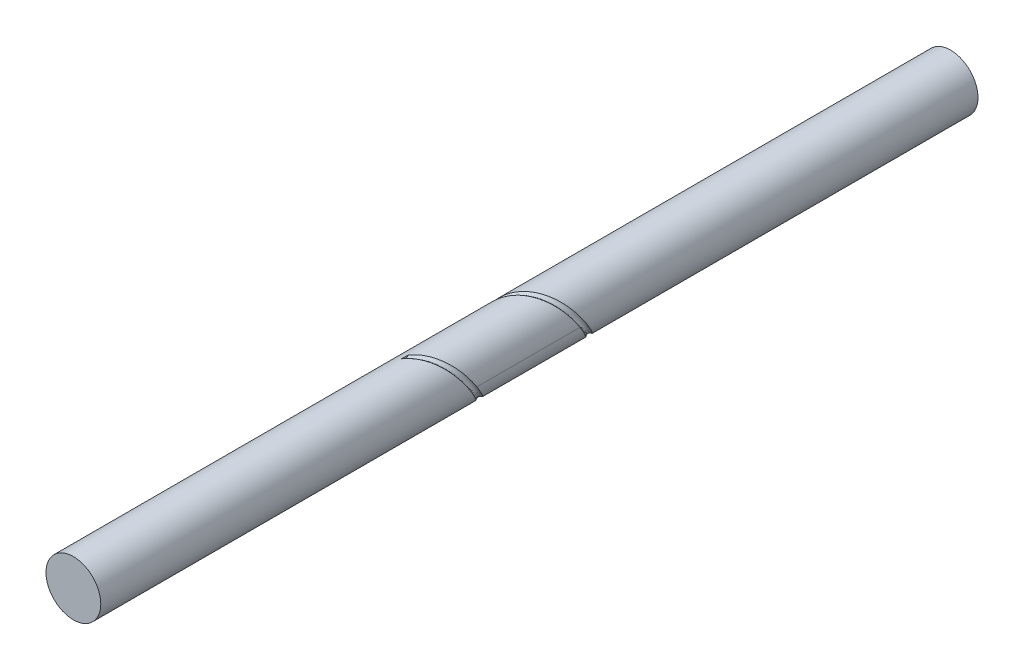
SolidWorks part; units mm, degrees
ref_plane "Front Plane" through (0, 0, 0) normal (0, 0, 1) x (1, 0, 0)
ref_plane "Top Plane" through (0, 0, 0) normal (0, 1, 0) x (1, 0, 0)
ref_plane "Right Plane" through (0, 0, 0) normal (1, 0, 0) x (0, 0, -1)
sketch "Sketch1" plane through (0, 0, 0) normal (0, 0, 1) x (1, 0, 0)
  circle A0 centre (0, 0) radius 25
  dimension "D1" = 50
extrude "Boss-Extrude1" add sketch "Sketch1" along normal blind 800
ref_plane "Plane1" through (0, 0, 310) normal (0, 0, 1) x (1, 0, 0)
sketch "Sketch2" plane through (0, 0, 310) normal (0, 0, 1) x (1, 0, 0)
  circle A0 centre (0, 0) radius 27.646
  dimension "D1" = 55.292
curve "Helix/Spiral1"
sketch "Sketch3" plane through (0, 0, 0) normal (0, 1, 0) x (1, 0, 0)
  circle A0 centre (-27.646, -310) radius 3.969
  spline S0 degree 3 poles (-27.646, -310) (-27.646, -311.3307) (-27.0608, -314.0012) (-24.4828, -317.9997) (-20.3663, -322.0001) (-14.9702, -326) (-8.6335, -330) (-1.7543, -334) (5.2352, -338) (11.8957, -342) (17.8087, -346) (22.6028, -350) (25.9766, -354) (27.7183, -358) (27.7183, -362) (25.9766, -366) (22.6028, -370) (17.8087, -374) (11.8957, -378) (5.2352, -382) (-1.7543, -386) (-8.6335, -390) (-14.9702, -394) (-20.3663, -398) (-24.4828, -402) (-27.0608, -406) (-27.9386, -410) (-27.0608, -414) (-24.4828, -418) (-20.3663, -422) (-14.9702, -426) (-8.6335, -430) (-1.7543, -434) (5.2352, -438) (11.8957, -442) (17.8087, -446) (22.6028, -450) (25.9766, -454) (27.7183, -458) (27.7183, -462) (25.9766, -466) (22.6028, -470) (17.8087, -474) (11.8958, -477.9999) (5.2346, -482.0003) (-1.7523, -485.9988) (-6.3447, -488.6693) (-8.5431, -490) knots 0 0 0 0 0.022222 0.044444 0.066667 0.088889 0.111111 0.133333 0.155556 0.177778 0.2 0.222222 0.244444 0.266667 0.288889 0.311111 0.333333 0.355556 0.377778 0.4 0.422222 0.444444 0.466667 0.488889 0.511111 0.533333 0.555556 0.577778 0.6 0.622222 0.644444 0.666667 0.688889 0.711111 0.733333 0.755556 0.777778 0.8 0.822222 0.844444 0.866667 0.888889 0.911111 0.933333 0.955556 0.977778 1 1 1 1 construction
  dimension "D1" = 7.938
sweep "Cut-Sweep1" cut profiles "Sketch3" path "Helix/Spiral1"
pattern_linear "LPattern1" [suppressed] count 2 spacing 500
